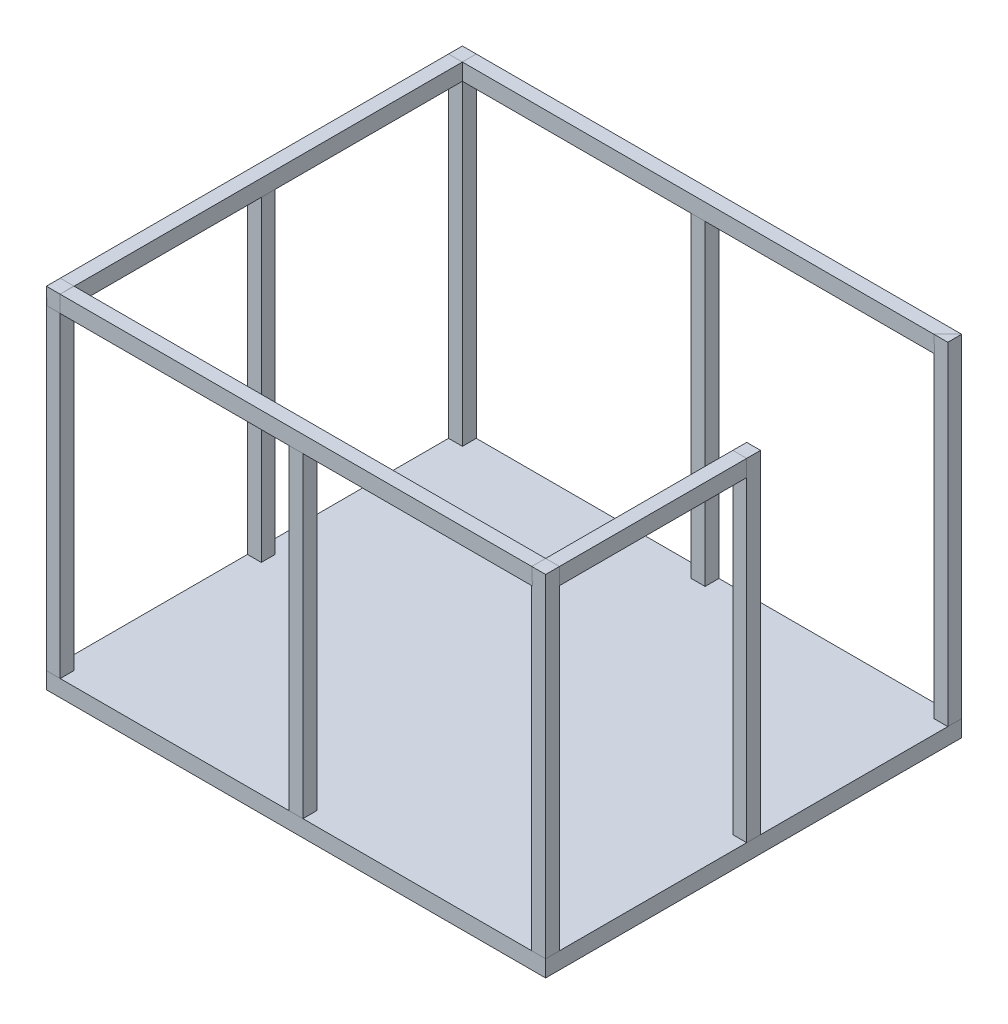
SolidWorks part; units mm, degrees
ref_plane "前视基准面" through (0, 0, 0) normal (0, 0, 1) x (1, 0, 0)
ref_plane "上视基准面" through (0, 0, 0) normal (0, 1, 0) x (1, 0, 0)
ref_plane "右视基准面" through (0, 0, 0) normal (1, 0, 0) x (0, 0, -1)
sketch "草图1" plane through (0, 0, 0) normal (0, 1, 0) x (1, 0, 0)
  line L1 (-900, -750) -> (900, -750)
  line L2 (-900, -750) -> (-900, 750)
  line L3 (-900, 750) -> (900, 750)
  line L4 (900, -750) -> (900, 750)
  line L5 (-900, -750) -> (900, 750) construction
  line L6 (-900, 750) -> (900, -750) construction
  point P0 (0, 0)
  dimension "D1" = 1800
  dimension "D2" = 1500
extrude "凸台-拉伸1" add sketch "草图1" along normal blind 60
sketch "草图2" plane through (0, 0, 0) normal (0, -1, 0) x (1, 0, 0)
  circle A0 centre (0, 0) radius 210
  dimension "D1" = 420
extrude "凸台-拉伸2" add sketch "草图2" along normal blind 10 separate body contours A0
sketch "草图3" plane through (0, 60, 0) normal (0, 1, 0) x (1, 0, 0)
  line L0 (0, 0) -> (0, 50000) construction
  line L1 (0, 0) -> (50000, 0) construction
  line L2 (900, -750) -> (900, 750) construction
  line L3 (900, -750) -> (850, -750)
  line L4 (900, -750) -> (900, -700)
  line L5 (900, -700) -> (850, -700)
  line L6 (850, -750) -> (850, -700)
  line L7 (-900, -750) -> (-850, -750)
  line L8 (-900, -750) -> (-900, -700)
  line L9 (-900, -700) -> (-850, -700)
  line L10 (-850, -750) -> (-850, -700)
  line L11 (900, 750) -> (850, 750)
  line L12 (900, 750) -> (900, 700)
  line L13 (900, 700) -> (850, 700)
  line L14 (850, 750) -> (850, 700)
  line L15 (-900, 750) -> (-850, 750)
  line L16 (-900, 750) -> (-900, 700)
  line L17 (-900, 700) -> (-850, 700)
  line L18 (-850, 750) -> (-850, 700)
  line L19 (900, -25) -> (850, -25)
  line L20 (900, -25) -> (900, 25)
  line L21 (900, 25) -> (850, 25)
  line L22 (850, -25) -> (850, 25)
  line L23 (-900, 750) -> (-900, -750) construction
  line L24 (-900, -25) -> (-850, -25)
  line L25 (-900, -25) -> (-900, 25)
  line L26 (-900, 25) -> (-850, 25)
  line L27 (-850, -25) -> (-850, 25)
  line L28 (900, 750) -> (-900, 750) construction
  line L29 (25, -750) -> (-25, -750)
  line L30 (25, -750) -> (25, -700)
  line L31 (25, -700) -> (-25, -700)
  line L32 (-25, -750) -> (-25, -700)
  line L33 (25, 750) -> (-25, 750)
  line L34 (25, 750) -> (25, 700)
  line L35 (25, 700) -> (-25, 700)
  line L36 (-25, 750) -> (-25, 700)
  line L37 (-900, -750) -> (900, -750) construction
  dimension "D1" = 50
  dimension "D2" = 50
  dimension "D3" = 50
  dimension "D4" = 50
  dimension "D5" = 50
extrude "凸台-拉伸3" add sketch "草图3" along normal blind 1200 separate body
sketch "草图4" plane through (900, 0, 0) normal (1, 0, 0) x (0, 0, -1)
  line L0 (-750, 1260) -> (-750, 60) construction
  line L1 (-750, 1260) -> (-700, 1260)
  line L2 (-750, 1260) -> (-750, 1200)
  line L3 (-750, 1200) -> (-700, 1200)
  line L4 (-700, 1260) -> (-700, 1200)
  line L5 (-700, 1260) -> (-700, 60) construction
  line L11 (750, 1260) -> (750, 60) construction
  line L12 (700, 1260) -> (750, 1260)
  line L13 (700, 1260) -> (700, 1200)
  line L14 (700, 1200) -> (750, 1200)
  line L15 (750, 1260) -> (750, 1200)
  line L16 (-750, 1260) -> (-700, 1260) construction
  dimension "D1" = 60
  dimension "D3" = 60
extrude "凸台-拉伸5" add sketch "草图4" against normal up to surface (1750 mm away) separate body
sketch "草图5" plane through (0, 0, 750) normal (0, 0, 1) x (1, 0, 0)
  line L1 (-900, 1260) -> (-850, 1260)
  line L2 (-900, 1260) -> (-900, 1200)
  line L3 (-900, 1200) -> (-850, 1200)
  line L4 (-850, 1260) -> (-850, 1200)
extrude "凸台-拉伸6" add sketch "草图5" against normal up to surface (1450 mm away) separate body
sketch "草图6" plane through (0, 0, 750) normal (0, 0, 1) x (1, 0, 0)
  line L0 (850, 1260) -> (850, 60) construction
  line L1 (900, 1260) -> (850, 1260)
  line L2 (900, 1260) -> (900, 1200)
  line L3 (900, 1200) -> (850, 1200)
  line L4 (850, 1260) -> (850, 1200)
extrude "凸台-拉伸7" add sketch "草图6" against normal up to surface (725 mm away) separate body
